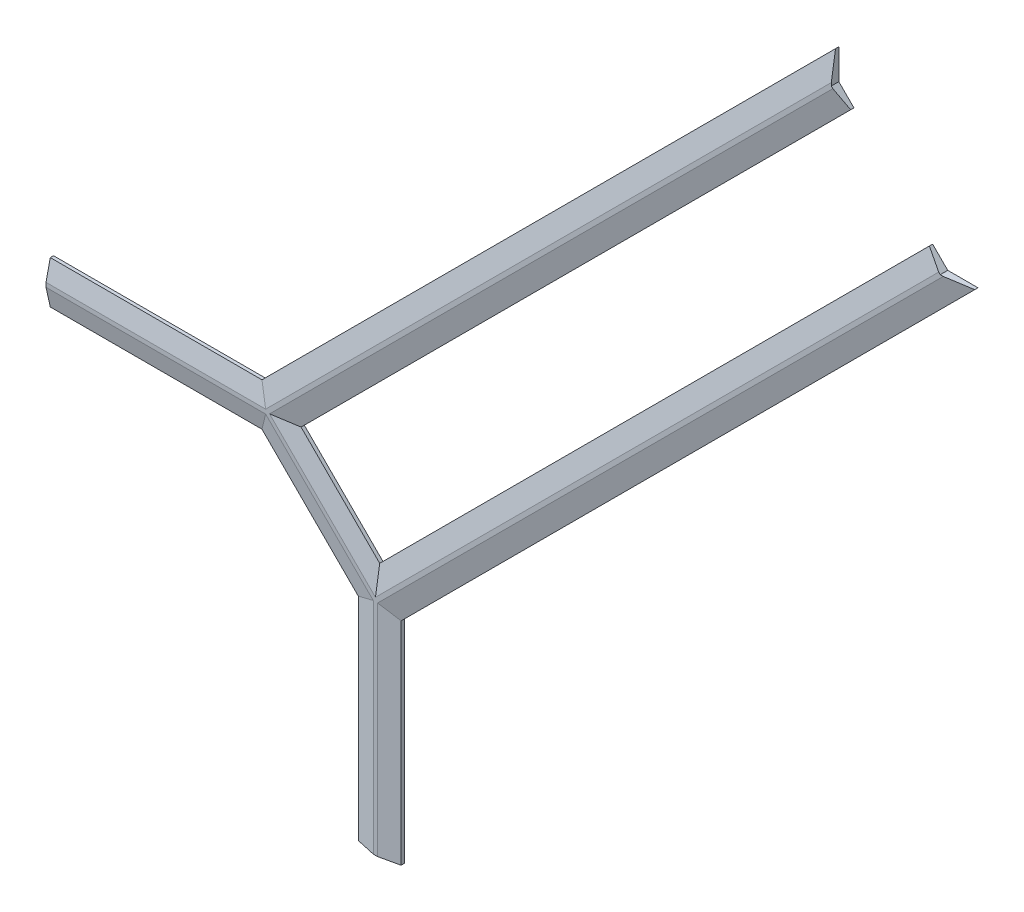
SolidWorks part; units mm, degrees
ref_plane "Front Plane" through (0, 0, 0) normal (0, 0, 1) x (1, 0, 0)
ref_plane "Top Plane" through (0, 0, 0) normal (0, 1, 0) x (1, 0, 0)
ref_plane "Right Plane" through (0, 0, 0) normal (1, 0, 0) x (0, 0, -1)
sketch "Sketch1" plane through (0, 0, 0) normal (0, 0, 1) x (1, 0, 0)
  line L0 (-869.3892, -546.1) -> (807.0108, 1130.3) construction
  line L1 (-546.1, -869.3892) -> (1130.3, 807.0108) construction
  line L2 (-895.6918, -482.6) -> (-482.6, -895.6918) construction
  line L3 (-546.1, -869.3892) -> (-869.3892, -546.1) construction
  line L4 (-779.5867, -546.1) -> (807.0108, 1040.4974)
  line L5 (807.0108, 1040.4974) -> (1040.4974, 807.0108) construction
  line L6 (1040.4974, 807.0108) -> (-546.1, -779.5867)
  line L7 (-779.5867, -546.1) -> (-546.1, -779.5867)
  line L8 (-609.6, -1524) -> (-482.6, -1524)
  line L9 (807.0108, 1130.3) -> (807.0108, 1040.4974) construction
  line L10 (1040.4974, 807.0108) -> (1130.3, 807.0108) construction
  line L11 (1139.2803, 807.0108) -> (1511.3, 807.0108) construction
  line L12 (206.5459, -206.5459) -> (-206.5459, 206.5459) construction
  line L13 (1524, 1524) -> (-1524, -1524) construction
  line L14 (-546.1, -1524) -> (-546.1, -779.5867) construction
  line L15 (-1524, -546.1) -> (-779.5867, -546.1) construction
  line L16 (1220.1026, 807.0108) -> (-482.6, -895.6918)
  line L17 (807.0108, 1220.1026) -> (-895.6918, -482.6)
  line L18 (-609.6, -1524) -> (-482.6, -1524) construction
  line L19 (-1524, -1524) -> (1524, -1524) construction
  line L20 (-1524, -482.6) -> (-1524, -609.6) construction
  line L21 (-1524, 1524) -> (-1524, -1524) construction
  line L22 (-1524, -482.6) -> (-895.6918, -482.6)
  line L23 (-482.6, -895.6918) -> (-482.6, -1524)
  line L24 (-1524, -609.6) -> (-895.6918, -609.6)
  line L25 (-869.3892, -546.1) -> (-895.6918, -482.6) construction
  line L26 (-546.1, -869.3892) -> (-482.6, -895.6918) construction
  line L27 (1040.4974, 807.0108) -> (1085.3987, 851.9121)
  line L28 (807.0108, 1040.4974) -> (851.9121, 1085.3987)
  line L29 (1085.3987, 851.9121) -> (1130.3, 807.0108)
  line L30 (-609.6, -895.6918) -> (-609.6, -1524)
  line L31 (-895.6918, -609.6) -> (-609.6, -895.6918)
  line L32 (-869.3892, -546.1) -> (-895.6918, -609.6) construction
  line L33 (-609.6, -895.6918) -> (-546.1, -869.3892) construction
  line L43 (-1524, -482.6) -> (-1524, -609.6)
  line L45 (1130.3, 807.0108) -> (1220.1026, 807.0108)
  line L46 (807.0108, 1511.3) -> (807.0108, 1139.2803) construction
  line L47 (807.0108, 1220.1026) -> (807.0108, 1130.3)
  line L48 (807.0108, 1130.3) -> (851.9121, 1085.3987)
  point P11 (-707.7446, -707.7446)
  dimension "D2" = 63.5
  dimension "D3" = 63.5
  dimension "D4" = 63.5
  dimension "D5" = 63.5
  dimension "D6" = 63.5
  dimension "D7" = 63.5
  dimension "D8" = 63.5
  dimension "D9" = 914.4
  dimension "D10" = 914.4
  dimension "D11" = 63.5
  dimension "D12" = 63.5
extrude "Extrude1" add sketch "Sketch1" along normal blind 22.352
chamfer "Chamfer1" distance 12.7 distance2 57.15 10 edges at (-609.6, -1209.8459, 22.352) (-752.6459, -752.6459, 22.352) (-1209.8459, -609.6, 22.352) (-482.6, -1209.8459, 22.352) (368.7513, -44.3405, 22.352) (-1209.8459, -482.6, 22.352) (-44.3405, 368.7513, 22.352) (-662.8433, -662.8433, 22.352) (36.1627, 269.6494, 22.352) (269.6494, 36.1627, 22.352)
